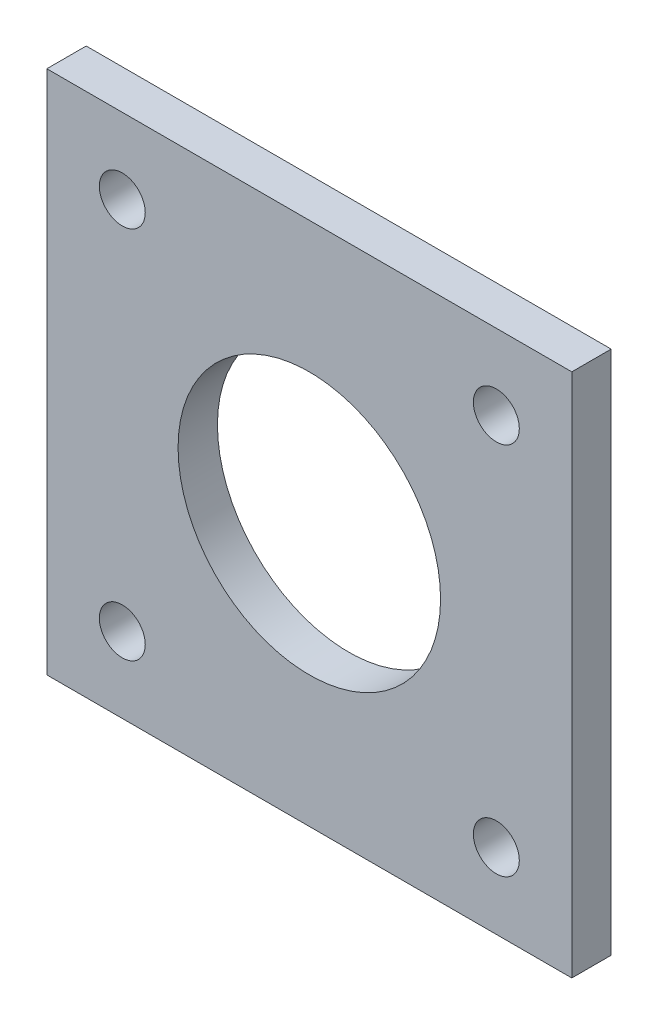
SolidWorks part; units mm, degrees
ref_plane "前视基准面" through (0, 0, 0) normal (0, 0, 1) x (1, 0, 0)
ref_plane "上视基准面" through (0, 0, 0) normal (0, 1, 0) x (1, 0, 0)
ref_plane "右视基准面" through (0, 0, 0) normal (1, 0, 0) x (0, 0, -1)
sketch "草图1" plane through (0, 0, 0) normal (0, 0, 1) x (1, 0, 0)
  line L1 (-20, 20) -> (20, 20)
  line L2 (-20, 20) -> (-20, -20)
  line L3 (-20, -20) -> (20, -20)
  line L4 (20, 20) -> (20, -20)
  line L5 (-20, 20) -> (20, -20) construction
  line L6 (-20, -20) -> (20, 20) construction
  point P0 (0, 0)
  dimension "D1" = 40
  dimension "D2" = 40
extrude "凸台-拉伸1" add sketch "草图1" along normal blind 3
hole_wizard "Ø3.5 (3.5) 直径孔1" positions "草图2" profile "草图3" hole size "Ø3.5" standard "GB"
sketch "草图2" plane through (0, 0, 3) normal (0, 0, 1) x (1, 0, 0)
  point P0 (-14.25, 14.25)
  point P2 (14.25, 14.25)
  point P4 (14.25, -14.25)
  point P6 (-14.25, -14.25)
  dimension "D1" = 28.5
  dimension "D2" = 28.5
  dimension "D3" = 28.5
  dimension "D4" = 28.5
  dimension "D5" = 14.25
  dimension "D6" = 14.25
  dimension "D7" = 14.25
  dimension "D8" = 14.25
sketch "草图3" plane through (-14.25, 14.25, 3) normal (1, 0, 0) x (0, -1, 0)
  line L0 (0, 0) -> (0, 6.0515)
  line L1 (0, 6.0515) -> (1.75, 5)
  line L2 (1.75, 5) -> (1.75, 0)
  line L5 (1.75, 0) -> (0, 0)
  line L10 (0, 6.0515) -> (-1.75, 5) construction
  line L11 (0, -6.35) -> (0, 107.95) construction
  dimension "孔直径" = 3.5
  dimension "孔深度" = 5
  dimension "导头角度" = 118
sketch "草图4" plane through (0, 0, 3) normal (0, 0, 1) x (1, 0, 0)
  circle A0 centre (0, 0) radius 10
  dimension "D1" = 20
extrude "切除-拉伸1" cut sketch "草图4" against normal blind 3
